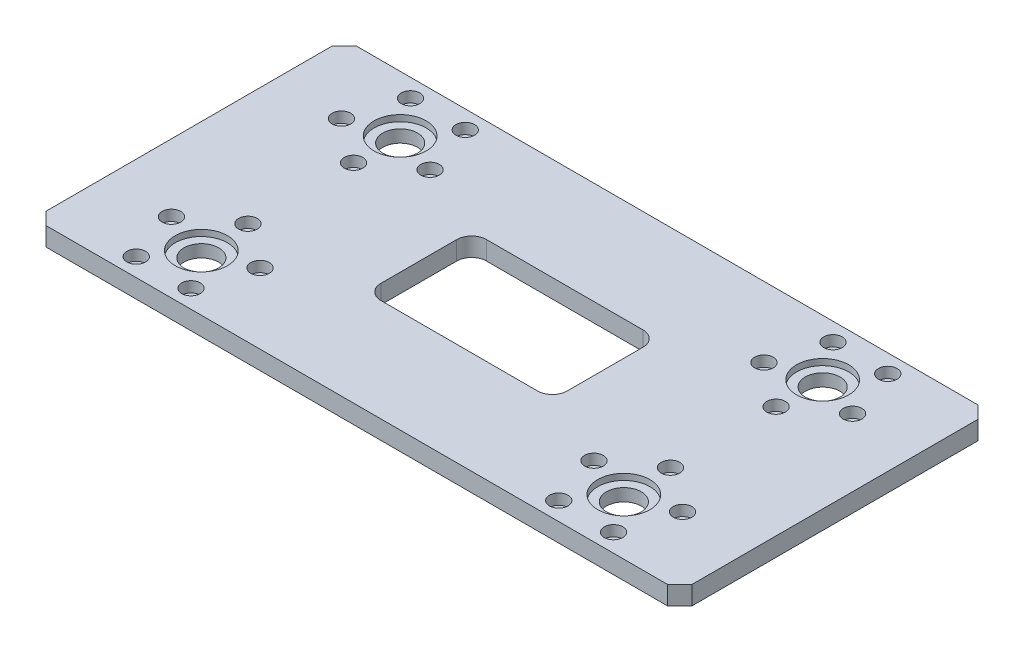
SolidWorks part; units mm, degrees
ref_plane "Front" through (0, 0, 0) normal (0, 0, 1) x (1, 0, 0)
ref_plane "Top" through (0, 0, 0) normal (0, 1, 0) x (1, 0, 0)
ref_plane "Right" through (0, 0, 0) normal (1, 0, 0) x (0, 0, -1)
sketch "Sketch1" plane through (0, 0, 0) normal (0, 1, 0) x (1, 0, 0)
  line L0 (-260, 125) -> (260, -125) construction
  line L1 (-260, 125) -> (260, 125)
  line L2 (-260, 125) -> (-260, -125)
  line L3 (-260, -125) -> (260, -125)
  line L4 (260, 125) -> (260, -125)
  dimension "D1" = 520
  dimension "D2" = 250
extrude "Boss-Extrude1" add sketch "Sketch1" along normal blind 15
chamfer "Chamfer1" distance 10 angle 45 4 edges at (260, 7.5, -125) (260, 7.5, 125) (-260, 7.5, -125) (-260, 7.5, 125)
sketch "Sketch2" plane through (0, 15, 0) normal (0, 1, 0) x (1, 0, 0)
  line L0 (260, -115) -> (260, 115) construction
  line L1 (-250, -125) -> (250, -125) construction
  circle A0 centre (170, -80) radius 21
  dimension "D3" = 42
  dimension "D1" = 90
  dimension "D2" = 45
extrude "Cut-Extrude1" cut sketch "Sketch2" against normal blind 5
sketch "Sketch3" plane through (0, 10, 0) normal (0, 1, 0) x (1, 0, 0)
  circle A0 centre (170, -80) radius 14
  dimension "D1" = 28
extrude "Cut-Extrude2" cut sketch "Sketch3" against normal through all
hole_wizard "CBORE for M8 Hex Socket Head Cap Screw1" positions "Sketch5" profile "Sketch4" counterbore size "M8" standard "ISO"
sketch "Sketch5" plane through (0, 15, 0) normal (0, 1, 0) x (1, 0, 0)
  circle A0 centre (170, -80) radius 37.5 construction
  point P0 (170, -42.5)
  dimension "D1" = 75
sketch "Sketch4" plane through (170, 15, 42.5) normal (1, 0, 0) x (0, 0, 1)
  line L0 (0, 0) -> (0, 15)
  line L1 (0, 15) -> (4.5, 15)
  line L3 (4.5, 15) -> (4.5, 8.6)
  line L4 (4.5, 8.6) -> (7.5, 8.6)
  line L5 (7.5, 8.6) -> (7.5, 0)
  line L7 (7.5, 0) -> (0, 0)
  line L11 (0, -6.35) -> (0, 107.95) construction
  dimension "Thru Hole Dia." = 9
  dimension "Thru Hole Depth" = 15
  dimension "C'Bore Dia." = 15
  dimension "C'Bore Depth" = 8.6
pattern_circular "CirPattern1" count 5 over 360 about axis through (170, 0, 80) along (0, 1, 0) of "CBORE for M8 Hex Socket Head Cap Screw1"
mirror "Mirror1" about plane through (0, 0, 0) normal (0, 0, 1) of "Cut-Extrude1", "Cut-Extrude2", "CirPattern1", "CBORE for M8 Hex Socket Head Cap Screw1"
mirror "Mirror2" about plane through (0, 0, 0) normal (1, 0, 0) of "Mirror1", "Cut-Extrude1", "Cut-Extrude2", "CBORE for M8 Hex Socket Head Cap Screw1", "CirPattern1"
sketch "Sketch6" plane through (0, 0, 0) normal (0, 1, 0) x (1, 0, 0)
  line L1 (-75, 42.5) -> (75, 42.5)
  line L2 (-75, 42.5) -> (-75, -42.5)
  line L3 (-75, -42.5) -> (75, -42.5)
  line L4 (75, 42.5) -> (75, -42.5)
  line L5 (-75, 42.5) -> (75, -42.5) construction
  line L6 (-75, -42.5) -> (75, 42.5) construction
  point P0 (0, 0)
  dimension "D1" = 150
  dimension "D2" = 85
extrude "Cut-Extrude7" cut sketch "Sketch6" along normal through all
fillet "Fillet1" radius 12 4 edges at (-75, 7.5, 42.5) (75, 7.5, 42.5) (75, 7.5, -42.5) (-75, 7.5, -42.5)
